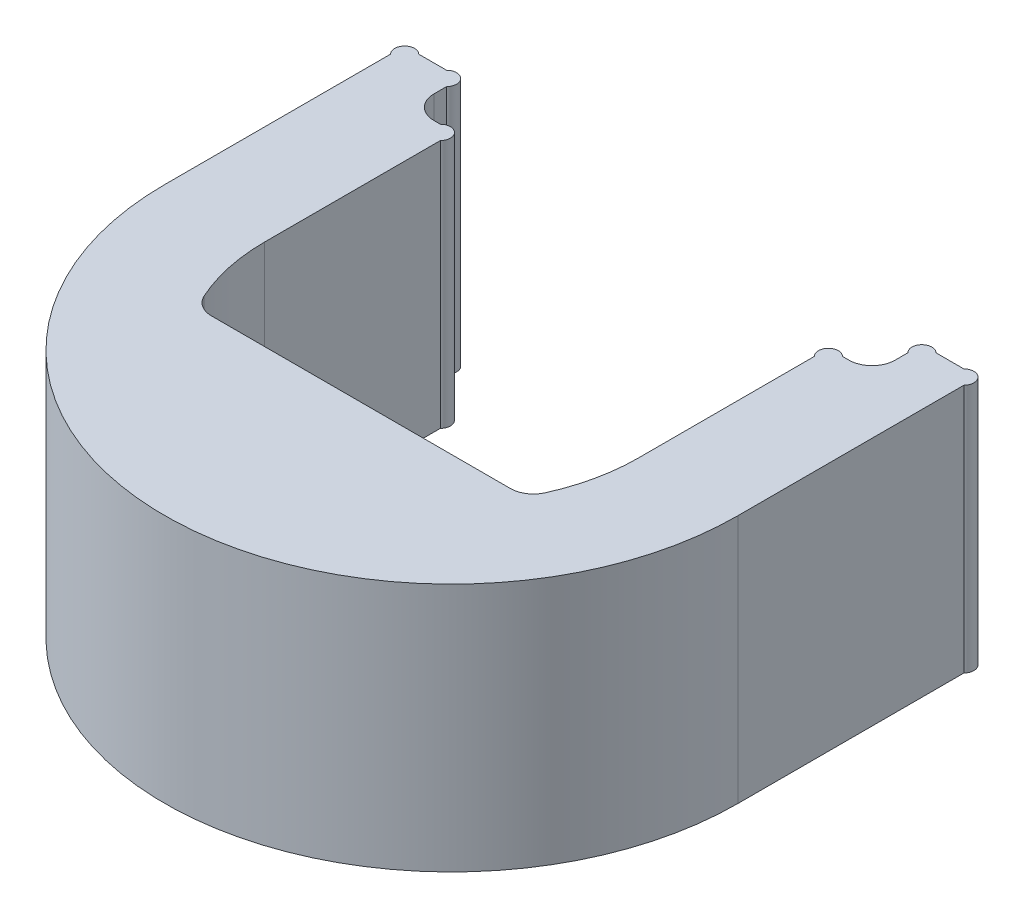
SolidWorks part; units mm, degrees
ref_plane "Plan de face" through (0, 0, 0) normal (0, 0, 1) x (1, 0, 0)
ref_plane "Plan de dessus" through (0, 0, 0) normal (0, 1, 0) x (1, 0, 0)
ref_plane "Plan de droite" through (0, 0, 0) normal (1, 0, 0) x (0, 0, -1)
sketch "Esquisse1" plane through (0, 0, 0) normal (0, 1, 0) x (1, 0, 0)
  line L0 (-9.5022, 0) -> (72.0857, 0) construction
  line L1 (37.5, 0) -> (37.5, 52.7511) construction
  line L2 (-23.9802, -44.5) -> (23.9802, -44.5)
  line L3 (0, -36.9756) -> (0, 41.4803) construction
  line L4 (45.5, 41.4803) -> (45.5, -71.2706) construction
  line L5 (65.4792, -30) -> (-63.2154, -30) construction
  line L6 (30.5, 4.1315) -> (30.5, -40.2641) construction
  line L7 (72.0857, 8) -> (30, 8) construction
  line L8 (65.4792, -45) -> (-31.5042, -45) construction
  line L9 (37, 8.5) -> (41.6167, 3.8833) construction
  line L10 (30, 0.5) -> (35.0518, -4.5518) construction
  line L11 (46, 8.5) -> (41.6445, 4.1445) construction
  line L12 (39.2627, 8.5) -> (43.7373, 8.5)
  line L20 (30, -30) -> (30, -1.7627)
  line L21 (32.2627, 0.5) -> (33.3, 0.5)
  line L22 (37, 4.2) -> (37, 6.2373)
  line L24 (46, 6.2373) -> (46, -30)
  line L25 (-46, 6.2373) -> (-46, -30)
  line L26 (-39.2627, 8.5) -> (-43.7373, 8.5)
  line L27 (-37, 4.2) -> (-37, 6.2373)
  line L28 (-32.2627, 0.5) -> (-33.3, 0.5)
  line L29 (-30, -30) -> (-30, -1.7627)
  arc A0 (-32.2627, 0.5) -> (-30, -1.7627) centre (-31.1314, -0.6314) cw
  arc A1 (46, 6.2373) -> (43.7373, 8.5) centre (44.8686, 7.3686) ccw
  arc A2 (32.2627, 0.5) -> (30, -1.7627) centre (31.1314, -0.6314) ccw
  arc A3 (-39.2627, 8.5) -> (-37, 6.2373) centre (-38.1314, 7.3686) cw
  arc A4 (39.2627, 8.5) -> (37, 6.2373) centre (38.1314, 7.3686) ccw
  arc A5 (-46, 6.2373) -> (-43.7373, 8.5) centre (-44.8686, 7.3686) cw
  arc A7 (23.9802, -44.5) -> (27.3538, -42.3194) centre (23.9802, -40.8) ccw
  arc A8 (27.3538, -42.3194) -> (30, -30) centre (0, -30) ccw
  arc A9 (37, 4.2) -> (33.3, 0.5) centre (33.3, 4.2) cw
  arc A10 (-46, -30) -> (46, -30) centre (0, -30) ccw
  arc A11 (-37, 4.2) -> (-33.3, 0.5) centre (-33.3, 4.2) ccw
  arc A12 (-30, -30) -> (-27.3538, -42.3194) centre (0, -30) ccw
  arc A13 (-23.9802, -44.5) -> (-27.3538, -42.3194) centre (-23.9802, -40.8) cw
  point P34 (26.5565, -45)
  point P37 (-26.5565, -45)
  point P40 (-37.5, 0)
  dimension "D1" = 37.5
  dimension "D2" = 45
  dimension "D8" = 45
  dimension "D3" = 8
  dimension "D4" = 30
  dimension "D5" = 15
  dimension "D6" = 8
  dimension "D7" = 15
  dimension "D9" = 45
extrude "Boss.-Extru.1" add sketch "Esquisse1" along normal blind 40
